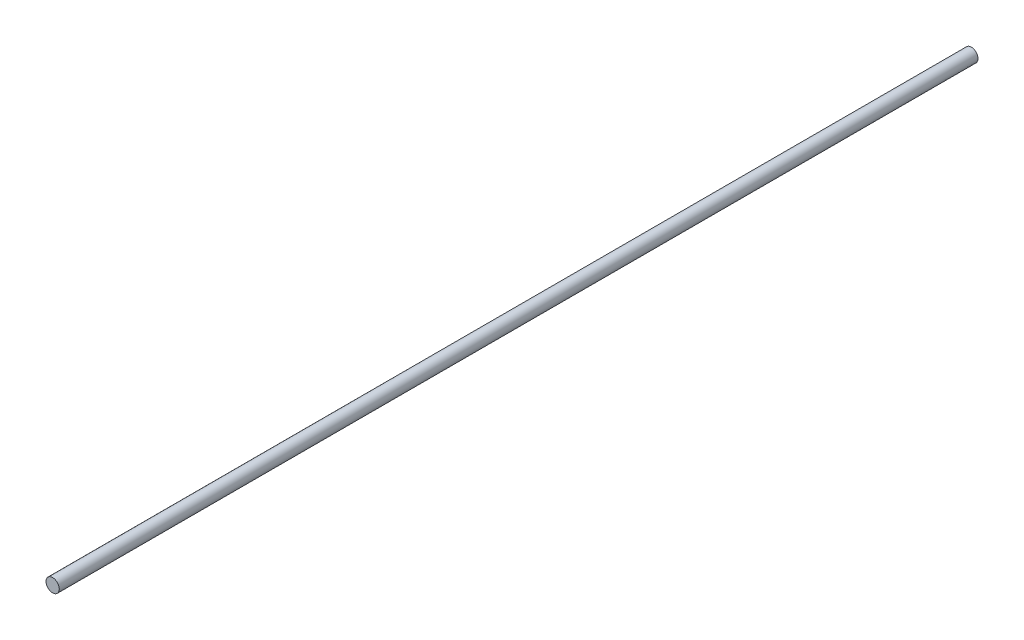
SolidWorks part; units mm, degrees
ref_plane "Front Plane" through (0, 0, 0) normal (0, 0, 1) x (1, 0, 0)
ref_plane "Top Plane" through (0, 0, 0) normal (0, 1, 0) x (1, 0, 0)
ref_plane "Right Plane" through (0, 0, 0) normal (1, 0, 0) x (0, 0, -1)
sketch "Sketch1" plane through (0, 0, 0) normal (0, 0, 1) x (1, 0, 0)
  circle A0 centre (0, 0) radius 30
  dimension "D1" = 60
extrude "Boss-Extrude1" add sketch "Sketch1" against normal blind 4150
